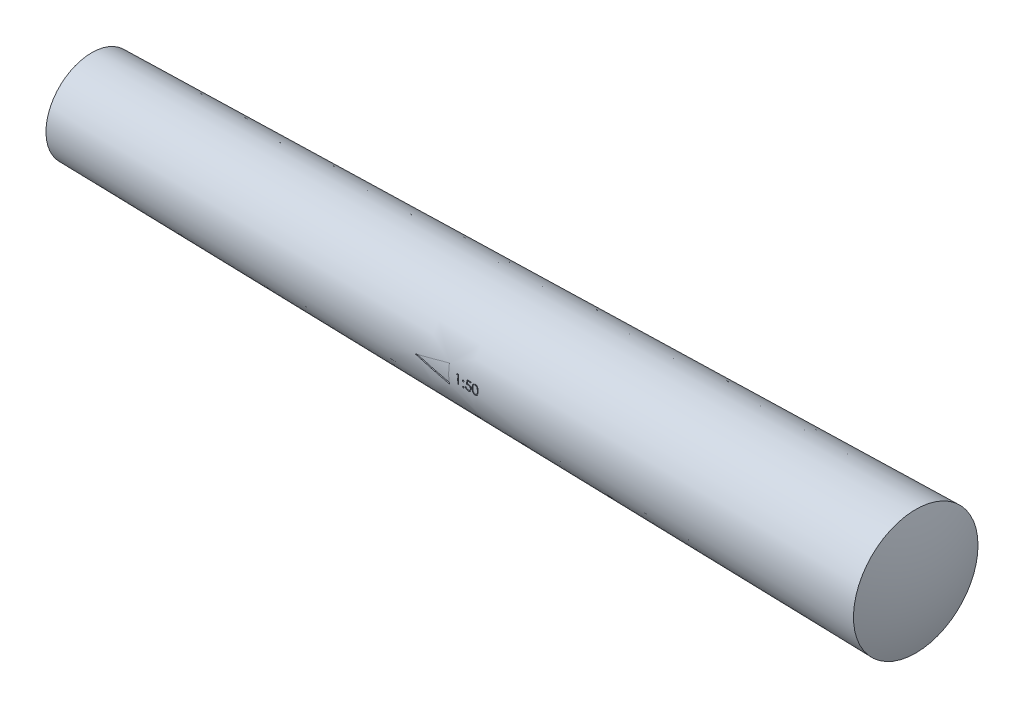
SolidWorks part; units mm, degrees
ref_plane "Front Plane" through (0, 0, 0) normal (0, 0, 1) x (1, 0, 0)
ref_plane "Top Plane" through (0, 0, 0) normal (0, 1, 0) x (1, 0, 0)
ref_plane "Right Plane" through (0, 0, 0) normal (1, 0, 0) x (0, 0, -1)
sketch "Sketch1" plane through (0, 0, 0) normal (1, 0, 0) x (0, 0, -1)
  circle A0 centre (0, 0) radius 5
  dimension "D1" = 10
extrude "Extrude1" add sketch "Sketch1" along normal mid plane 90
draft "Draft1" type of draft neutral plane draft angle 1.146 faces to draft 1 parameters "D1"=1.146
sketch "Sketch2" plane through (0, 0, 0) normal (0, 0, 1) x (1, 0, 0)
  line L0 (-45, 0) -> (-45, 5)
  line L1 (-45, 5) -> (-45, -5) construction
  line L2 (-45, 0) -> (-46.2, 0)
  line L3 (-46.2, 0) -> (-46.2, -5.9) construction
  line L4 (45, 0) -> (45, 6.8001)
  line L5 (45, -6.8001) -> (45, 6.8001) construction
  line L6 (45, 0) -> (46.2, 0)
  line L7 (46.2, 0) -> (46.2, -5.9) construction
  line L8 (-45, -5) -> (45, -6.8001) construction
  arc A0 (-46.2, 0) -> (-45, 5) centre (-35.1833, 0) cw
  arc A1 (46.2, 0) -> (45, 6.8001) centre (26.333, 0) ccw
  point P14 (0, -5.9)
revolve "Revolve1" add sketch "Sketch2" angle 360 about L2
sketch "Sketch5" plane through (0, 0, 0) normal (0, 0, 1) x (1, 0, 0)
  line L0 (0, 5.9) -> (0, -5.9) construction
  line L1 (45, 6.8001) -> (-45, 5) construction
  line L2 (-45, -5) -> (45, -6.8001) construction
ref_plane "Plane2" through (0, 0, 0) normal (-0.02, 0, 0.9998) x (0.9998, 0, 0.02)
sketch "Sketch6" plane through (0, 0, 0) normal (-0.02, 0, 0.9998) x (0.9998, 0, 0.02)
  line L0 (0, 0) -> (0, 1)
  line L1 (0, 5.9) -> (0, -5.9) construction
  line L2 (0, 1) -> (-3.7321, 0)
  line L3 (-3.7321, 0) -> (0, -1)
  line L4 (0, -1) -> (0, 0)
  line L5 (0, -0.5) -> (4, -0.5) construction
  text T0 "1:50" font "Century Gothic" height 1
  dimension "D1" = 2
  dimension "D2" = 30
  dimension "D3" = 4
wrap "Wrap2" sketch "Sketch6" wrap type deboss source sketch "Sketch6" thickness 0.1 parameters "D1"=0.1
equation "\"D2@Sketch2\" = \"D1@Sketch2\""
